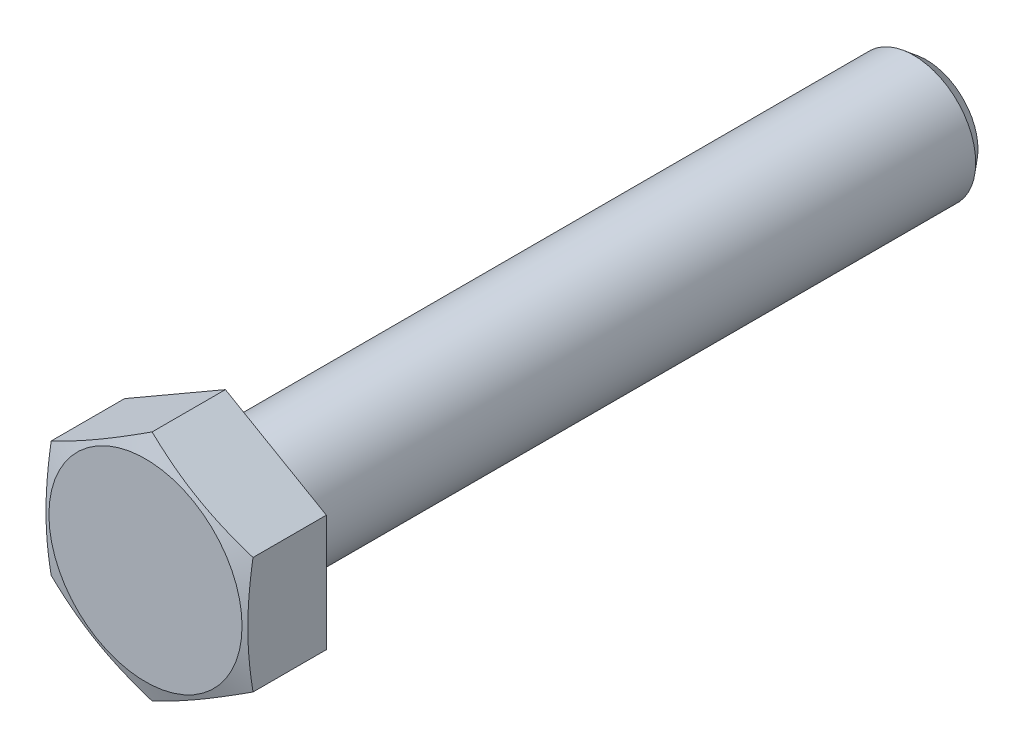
SolidWorks part; units mm, degrees
ref_plane "Plan1" through (0, 0, 0) normal (0, 0, 1) x (1, 0, 0)
ref_plane "Plan2" through (0, 0, 0) normal (0, 1, 0) x (1, 0, 0)
ref_plane "Plan3" through (0, 0, 0) normal (1, 0, 0) x (0, 0, -1)
imported_body "Vis H - M8x45 - 8,8"
sketch "Esquisse1" plane through (0, 0, -2.544) normal (0, 0, 1) x (1, 0, 0)
  circle A0 centre (0, 0) radius 4 construction
  circle A1 centre (0, 0) radius 4
extrude "Boss.-Extru.1" add sketch "Esquisse1" along normal up to next
